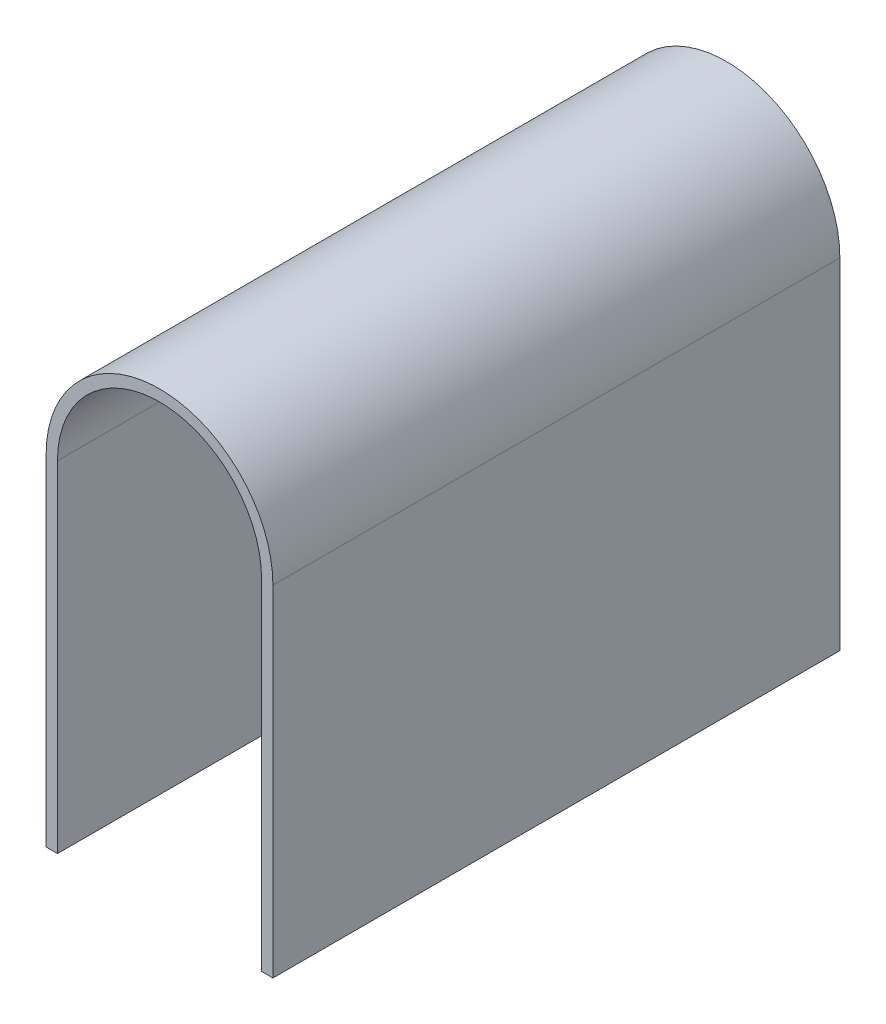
SolidWorks part; units mm, degrees
ref_plane "Plan de face" through (0, 0, 0) normal (0, 0, 1) x (1, 0, 0)
ref_plane "Plan de dessus" through (0, 0, 0) normal (0, 1, 0) x (1, 0, 0)
ref_plane "Plan de droite" through (0, 0, 0) normal (1, 0, 0) x (0, 0, -1)
sketch "Esquisse1" plane through (0, 0, 0) normal (0, 0, 1) x (1, 0, 0)
  line L0 (-90, 0) -> (-90, -300)
  line L1 (90, 0) -> (90, -300)
  line L2 (-100, 0) -> (-100, -300)
  line L3 (100, 0) -> (100, -300)
  line L4 (90, -300) -> (100, -300)
  line L5 (-100, -300) -> (-90, -300)
  arc A0 (90, 0) -> (-90, 0) centre (0, 0) ccw
  arc A1 (100, 0) -> (-100, 0) centre (0, 0) ccw
  dimension "D1" = 180
  dimension "D2" = 300
  dimension "D3" = 10
extrude "Extrusion1" add sketch "Esquisse1" along normal blind 500
